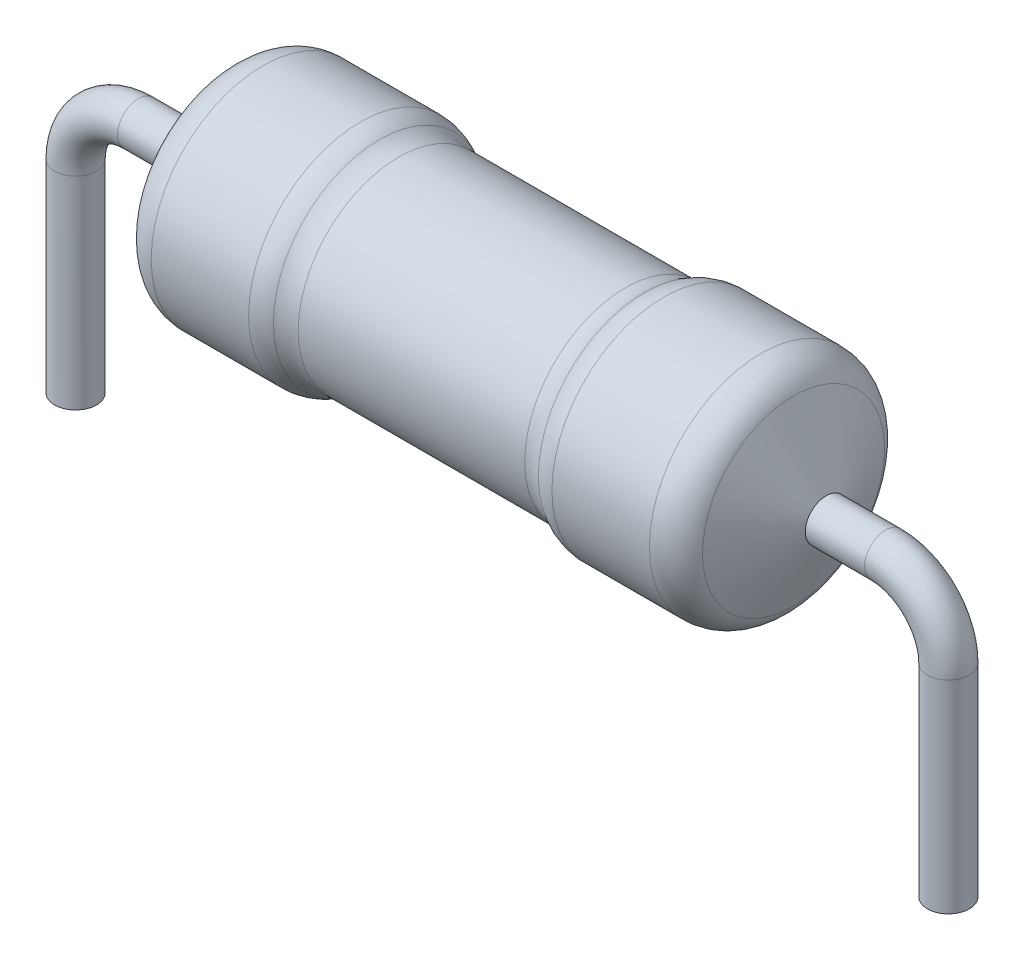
SolidWorks part; units mm, degrees
ref_plane "Front" through (0, 0, 0) normal (0, 0, 1) x (1, 0, 0)
ref_plane "Top" through (0, 0, 0) normal (0, 1, 0) x (1, 0, 0)
ref_plane "Right" through (0, 0, 0) normal (1, 0, 0) x (0, 0, -1)
sketch "Эскиз1" plane through (0, 0, 0) normal (0, 0, 1) x (1, 0, 0)
  line L0 (-4.5, 1.6) -> (-4.5, 1.3)
  line L1 (-4.5, 1.3) -> (-4.0316, 0.2956)
  line L2 (-3.5676, 0) -> (-2.1718, 0)
  line L3 (-1.6222, 0.16) -> (1.6222, 0.16)
  line L4 (0, 0.16) -> (0, 1.6) construction
  line L5 (0, 1.6) -> (-4.5, 1.6) construction
  line L6 (3.5676, 0) -> (2.1718, 0)
  line L7 (4.5, 1.3) -> (4.0316, 0.2956)
  line L8 (4.5, 1.6) -> (4.5, 1.3)
  line L9 (-4.5, 1.6) -> (4.5, 1.6)
  arc A0 (-2.1718, 0) -> (-1.897, 0.08) centre (-2.1718, 0.512) ccw
  arc A1 (-4.0316, 0.2956) -> (-3.5676, 0) centre (-3.5676, 0.512) ccw
  arc A2 (4.0316, 0.2956) -> (3.5676, 0) centre (3.5676, 0.512) cw
  arc A3 (2.1718, 0) -> (1.897, 0.08) centre (2.1718, 0.512) cw
  arc A4 (-1.897, 0.08) -> (-1.6222, 0.16) centre (-1.6222, -0.352) cw
  arc A5 (1.897, 0.08) -> (1.6222, 0.16) centre (1.6222, -0.352) ccw
  point P22 (-1.8, 0.16)
  point P25 (1.8, 0.16)
  dimension "D5" = 0.512
  dimension "D6" = 2.7
  dimension "D1" = 2.88
  dimension "L" = 9
  dimension "D" = 3.2
  dimension "D3" = 0.6
  dimension "D4" = 25
revolve "Повернуть1" add sketch "Эскиз1" angle 360 about L9
ref_plane "Плоскость1" through (0, -2.2, 0) normal (0, 1, 0) x (-1, 0, 0)
sketch "Эскиз2" plane through (0, -2.2, 0) normal (0, 1, 0) x (-1, 0, 0)
  line L1 (0, 0) -> (0, -1.44) construction
  line L2 (-1.6222, -1.44) -> (1.6222, -1.44) construction
  circle A0 centre (6.25, 0) radius 0.3
  dimension "D1" = 0.6
  dimension "L1" = 12.5
sketch "Эскиз3" plane through (0, 0, 0) normal (0, 0, 1) x (1, 0, 0)
  line L0 (-6.25, -2.2) -> (-6.25, 0.7)
  line L1 (-5.95, -2.2) -> (-6.55, -2.2) construction
  line L2 (-5.35, 1.6) -> (5.35, 1.6)
  line L3 (6.25, 0.7) -> (6.25, -2.2)
  line L4 (0, 0) -> (0, 1.6) construction
  line L5 (-4.5, 1.6) -> (4.5, 1.6) construction
  arc A0 (-6.25, 0.7) -> (-5.35, 1.6) centre (-5.35, 0.7) cw
  arc A1 (5.35, 1.6) -> (6.25, 0.7) centre (5.35, 0.7) cw
  dimension "D1" = 0.9
sweep "По траектории1" add profiles "Эскиз2" path "Эскиз3"
equation "\"D1@Эскиз1\" = \"D@Эскиз1\" * 0.9"
equation "\"D6@Эскиз1\" = \"L@Эскиз1\" * 0.3"
equation "\"D5@Эскиз1\" = \"D@Эскиз1\" * 0.16"
equation "\"D1@Эскиз2\" = \"D3@Эскиз1\""
equation "\"D1@Эскиз3\" = \"D3@Эскиз1\" * 1.5"
